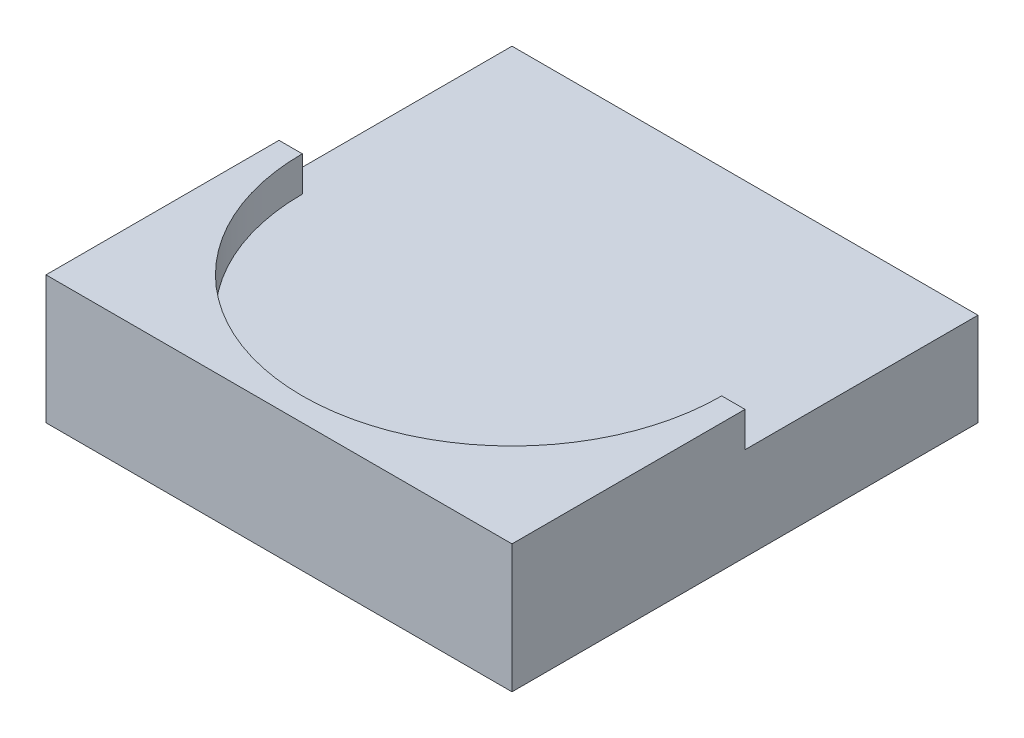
SolidWorks part; units mm, degrees
ref_plane "Alzado" through (0, 0, 0) normal (0, 0, 1) x (1, 0, 0)
ref_plane "Planta" through (0, 0, 0) normal (0, 1, 0) x (1, 0, 0)
ref_plane "Vista lateral" through (0, 0, 0) normal (1, 0, 0) x (0, 0, -1)
sketch "Croquis1" plane through (0, 0, 0) normal (0, 1, 0) x (1, 0, 0)
  line L1 (0, 0) -> (4, 0)
  line L2 (0, 0) -> (0, -4)
  line L3 (0, -4) -> (4, -4)
  line L4 (4, 0) -> (4, -4)
extrude "Saliente-Extruir1" add sketch "Croquis1" along normal blind 1.1
sketch "Croquis2" plane through (0, 1.1, 0) normal (0, 1, 0) x (1, 0, 0)
  line L0 (0.2, -2) -> (0, -2)
  line L1 (0, 0) -> (0, -4) construction
  line L2 (0, -2) -> (0, 0)
  line L3 (0, 0) -> (4, 0)
  line L4 (4, 0) -> (4, -2)
  line L5 (4, -4) -> (4, 0) construction
  line L6 (4, -2) -> (3.8, -2)
  arc A0 (0.2, -2) -> (3.8, -2) centre (2, -2) ccw
extrude "Cortar-Extruir1" cut sketch "Croquis2" against normal blind 0.3
